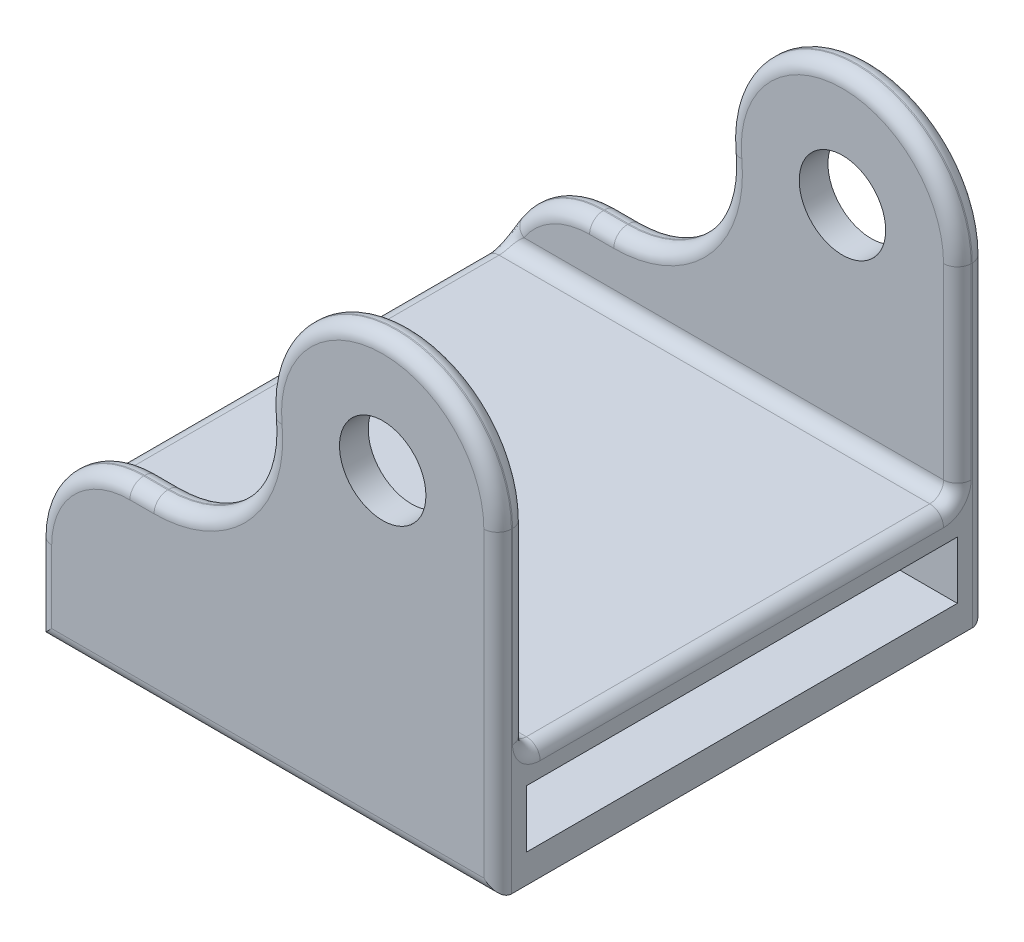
SolidWorks part; units mm, degrees
ref_plane "Front" through (0, 0, 0) normal (0, 0, 1) x (1, 0, 0)
ref_plane "Top" through (0, 0, 0) normal (0, 1, 0) x (1, 0, 0)
ref_plane "Right" through (0, 0, 0) normal (1, 0, 0) x (0, 0, -1)
sketch "Sketch1" plane through (0, 0, 0) normal (0, 0, 1) x (1, 0, 0)
  line L0 (0, 0) -> (-25.4, 0)
  line L1 (0, 0) -> (0, 12.7)
  line L2 (-18.9863, 5.08) -> (-20.32, 5.08)
  arc A0 (0, 12.7) -> (-12.6682, 12.065) centre (-6.35, 12.7) ccw
  arc A1 (-12.6682, 12.065) -> (-18.9863, 5.08) centre (-18.9863, 11.43) cw
  arc A2 (-20.32, 5.08) -> (-25.4, 0) centre (-20.32, 0) ccw
  dimension "D2" = 12.7
  dimension "D3" = 6.35
  dimension "D4" = 5.08
  dimension "D5" = 6.35
  dimension "D1" = 25.4
extrude "Extrude1" add sketch "Sketch1" along normal mid plane 26.9875
shell "Shell1" thickness 1.5875
sketch "Sketch2" plane through (0, 0, 13.4937) normal (0, 0, 1) x (1, 0, 0)
  circle A0 centre (-6.35, 12.7) radius 2.3876
  dimension "D1" = 4.7752
extrude "Cut-Extrude1" cut sketch "Sketch2" against normal through all
sketch "Sketch3" plane through (0, 0, 0) normal (0, -1, 0) x (1, 0, 0)
  line L4 (-25.4, -13.4937) -> (0, -13.4937)
  line L5 (0, -13.4937) -> (0, 13.4937)
  line L6 (0, 13.4937) -> (-25.4, 13.4937)
  line L7 (-25.4, 13.4937) -> (-25.4, -13.4937)
  line L8 (-25.4, -13.4937) -> (0, -13.4937)
  line L9 (0, -13.4937) -> (0, 13.4937)
  line L10 (0, 13.4937) -> (-25.4, 13.4937)
  line L11 (-25.4, 13.4937) -> (-25.4, -13.4937)
  dimension "D1" = 0
extrude "Extrude2" add sketch "Sketch3" along normal blind 4.7625
sketch "Sketch4" plane through (0, 0, 0) normal (1, 0, 0) x (0, 0, -1)
  line L0 (11.9062, 1.5875) -> (11.9062, 12.7) construction
  line L1 (-11.9062, 0) -> (11.9062, 0)
  line L2 (-11.9062, 0) -> (-11.9062, -3.175)
  line L3 (-11.9062, -3.175) -> (11.9062, -3.175)
  line L4 (11.9062, 0) -> (11.9062, -3.175)
  line L5 (-11.9062, 1.5875) -> (-11.9062, 12.7) construction
  line L7 (13.4937, -4.7625) -> (-13.4937, -4.7625) construction
  dimension "D1" = 3.175
  dimension "D2" = 1.5875
extrude "Cut-Extrude2" cut sketch "Sketch4" against normal through all
fillet "Fillet1" radius 0.762 28 edges at (0, 7.1437, 11.9062) (-6.6679, 19.042, 11.9062) (-14.2771, 7.1703, 11.9062) (-19.6532, 5.08, 11.9062) (0, 7.1437, -11.9062) (-6.6679, 19.042, -11.9062) (-14.2771, 7.1703, -11.9062) (-19.6532, 5.08, -11.9062) (0, 3.9688, 13.4937) (-6.6679, 19.042, 13.4937) (-14.2771, 7.1703, 13.4937) (-19.6532, 5.08, 13.4937) (-25.4, -2.3813, 13.4937) (0, 3.9688, -13.4937) (-6.6679, 19.042, -13.4937) (-14.2771, 7.1703, -13.4937) (-19.6532, 5.08, -13.4937) (-23.9121, 3.5921, -13.4937) (-12.7, -4.7625, -13.4937) (-12.7, -4.7625, 13.4937) (-12.5728, 1.5875, -11.9062) (-12.5728, 1.5875, 11.9062) (0, 1.5875, 0) (-25.1456, 1.5875, 0) (-23.2984, 4.1153, 11.9062) (-23.2984, 4.1153, -11.9062) (-23.9121, 3.5921, 13.4937) (-25.4, -2.3813, -13.4937)
